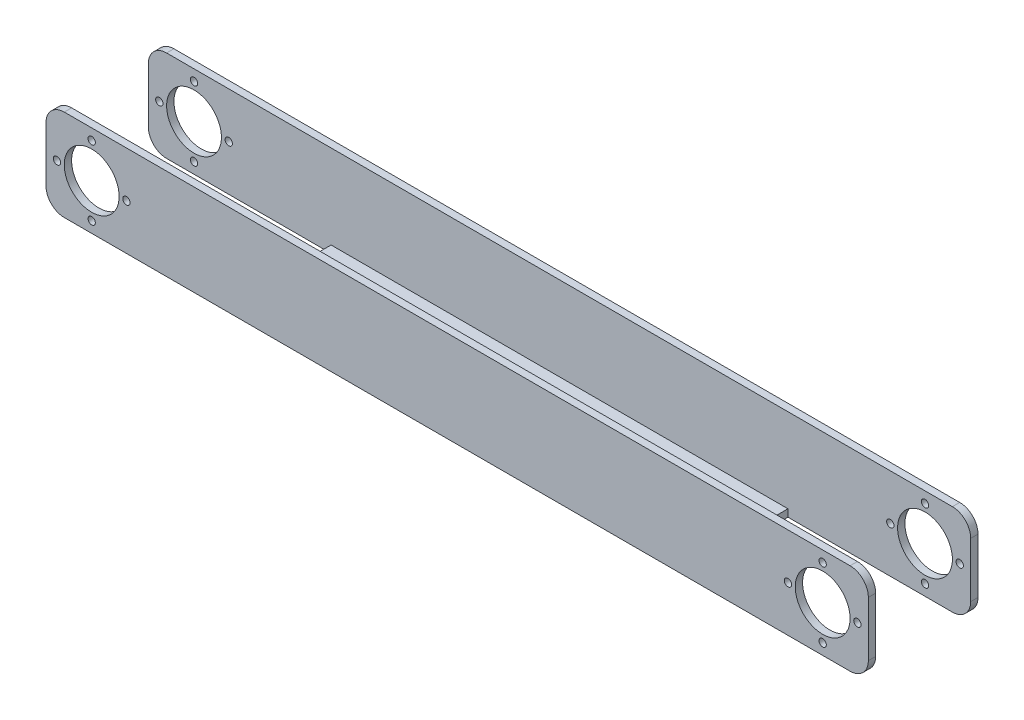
SolidWorks part; units mm, degrees
ref_plane "Front Plane" through (0, 0, 0) normal (0, 0, 1) x (1, 0, 0)
ref_plane "Top Plane" through (0, 0, 0) normal (0, 1, 0) x (1, 0, 0)
ref_plane "Right Plane" through (0, 0, 0) normal (1, 0, 0) x (0, 0, -1)
sketch "Sketch1" plane through (0, 0, 0) normal (0, 0, 1) x (1, 0, 0)
  line L1 (-112.5, -12.5) -> (112.5, -12.5)
  line L2 (-112.5, -12.5) -> (-112.5, 12.5)
  line L3 (-112.5, 12.5) -> (112.5, 12.5)
  line L5 (-112.5, -12.5) -> (112.5, 12.5) construction
  line L6 (-112.5, 12.5) -> (112.5, -12.5) construction
  line L9 (112.5, 12.5) -> (112.5, -12.5)
  point P0 (0, 0)
  dimension "D1" = 225
  dimension "D2" = 25
extrude "Boss-Extrude1" add sketch "Sketch1" along normal blind 30
shell "Shell1" thickness 2
sketch "Sketch5" plane through (0, -12.5, 0) normal (0, -1, 0) x (1, 0, 0)
  line L0 (-112.5, 2) -> (-112.5, 28)
  line L1 (-112.5, 2) -> (-62.5, 2)
  line L2 (-112.5, 28) -> (-62.5, 28)
  line L3 (-62.5, 2) -> (-62.5, 28)
  line L4 (112.5, 28) -> (112.5, 2)
  line L5 (112.5, 28) -> (62.5, 28)
  line L6 (112.5, 2) -> (62.5, 2)
  line L7 (62.5, 28) -> (62.5, 2)
  line L8 (112.5, 30) -> (112.5, 0) construction
  line L9 (-112.5, 30) -> (112.5, 30) construction
  dimension "D1" = 50
  dimension "D2" = 50
  dimension "D3" = 2
extrude "Cut-Extrude4" cut sketch "Sketch5" against normal through all
sketch "Sketch4" plane through (0, 0, 30) normal (0, 0, 1) x (1, 0, 0)
  line L1 (112.5, 12.5) -> (-112.5, 12.5) construction
  line L2 (112.5, -12.5) -> (112.5, 12.5) construction
  line L3 (0, 12.5) -> (0, -12.5) construction
  line L4 (112.5, 12.5) -> (-112.5, 12.5) construction
  line L5 (112.5, 12.5) -> (-112.5, 12.5) construction
  line L6 (-112.5, -12.5) -> (112.5, -12.5) construction
  circle A7 centre (-100, 0) radius 7.5
  circle A8 centre (100, 0) radius 7.5
  circle A9 centre (100, 9.5) radius 1
  circle A10 centre (109.5, 0) radius 1
  circle A11 centre (100, -9.5) radius 1
  circle A12 centre (90.5, 0) radius 1
  circle A13 centre (-90.5, 0) radius 1
  circle A14 centre (-100, -9.5) radius 1
  circle A15 centre (-109.5, 0) radius 1
  circle A16 centre (-100, 9.5) radius 1
  dimension "D2" = 100
  dimension "D3" = 12.5
  dimension "D4" = 12.5
  dimension "D5" = 15
  dimension "D6" = 15
  dimension "D12" = 2
  dimension "D13" = 2
  dimension "D15" = 12.5
  dimension "D16" = 12.5
  dimension "D17" = 12.5
  dimension "D18" = 12.5
  dimension "D8" = 9.5
  dimension "D11" = 2
  dimension "D14" = 2
  dimension "D1" = 100
  dimension "D7" = 9.5
  dimension "D9" = 9.5
  dimension "D10" = 9.5
extrude "Cut-Extrude3" cut sketch "Sketch4" against normal through all
fillet "Fillet2" radius 5 8 edges at (-112.5, -12.5, 1) (-112.5, 12.5, 1) (-112.5, -12.5, 29) (-112.5, 12.5, 29) (112.5, -12.5, 1) (112.5, -12.5, 29) (112.5, 12.5, 1) (112.5, 12.5, 29)
